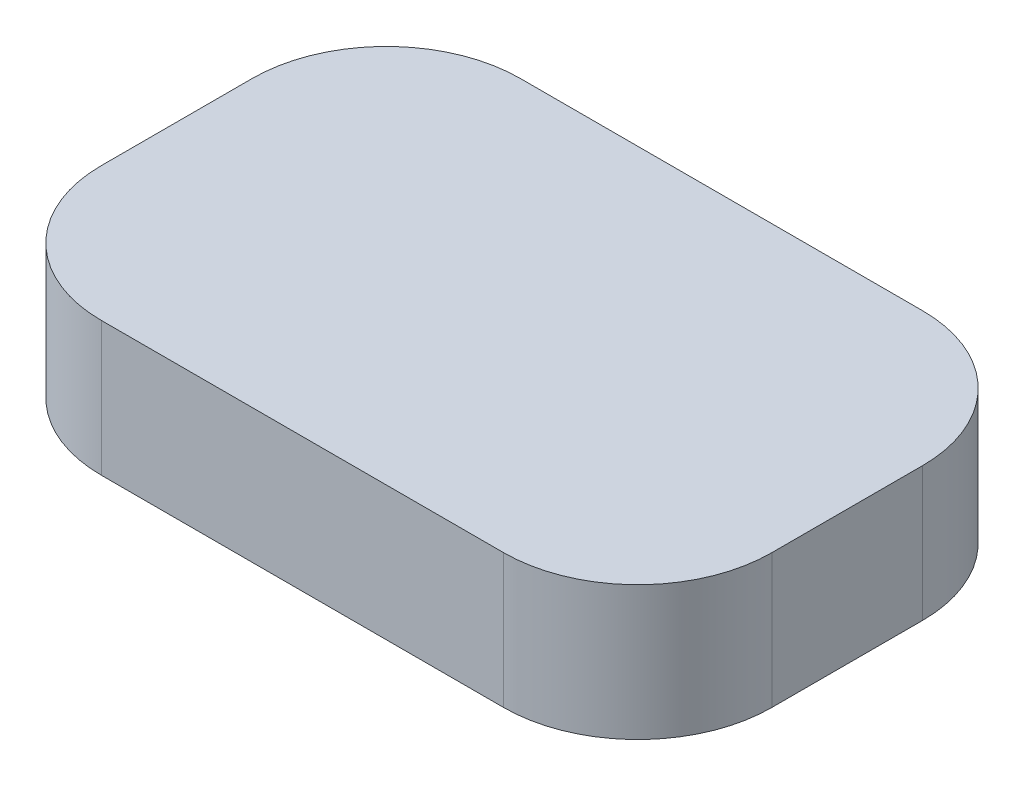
SolidWorks part; units mm, degrees
ref_plane "Front" through (0, 0, 0) normal (0, 0, 1) x (1, 0, 0)
ref_plane "Top" through (0, 0, 0) normal (0, 1, 0) x (1, 0, 0)
ref_plane "Right" through (0, 0, 0) normal (1, 0, 0) x (0, 0, -1)
sketch "Sketch1" plane through (0, 0, 0) normal (0, 1, 0) x (1, 0, 0)
  line L0 (100, -62.5) -> (-100, 62.5) construction
  line L1 (-100, 62.5) -> (100, 62.5)
  line L2 (-100, 62.5) -> (-100, -62.5)
  line L3 (-100, -62.5) -> (100, -62.5)
  line L4 (100, 62.5) -> (100, -62.5)
  dimension "D1" = 200
  dimension "D2" = 125
extrude "Extrude1" add sketch "Sketch1" along normal blind 40
fillet "Fillet1" radius 40 4 edges at (-100, 20, -62.5) (-100, 20, 62.5) (100, 20, -62.5) (100, 20, 62.5)
